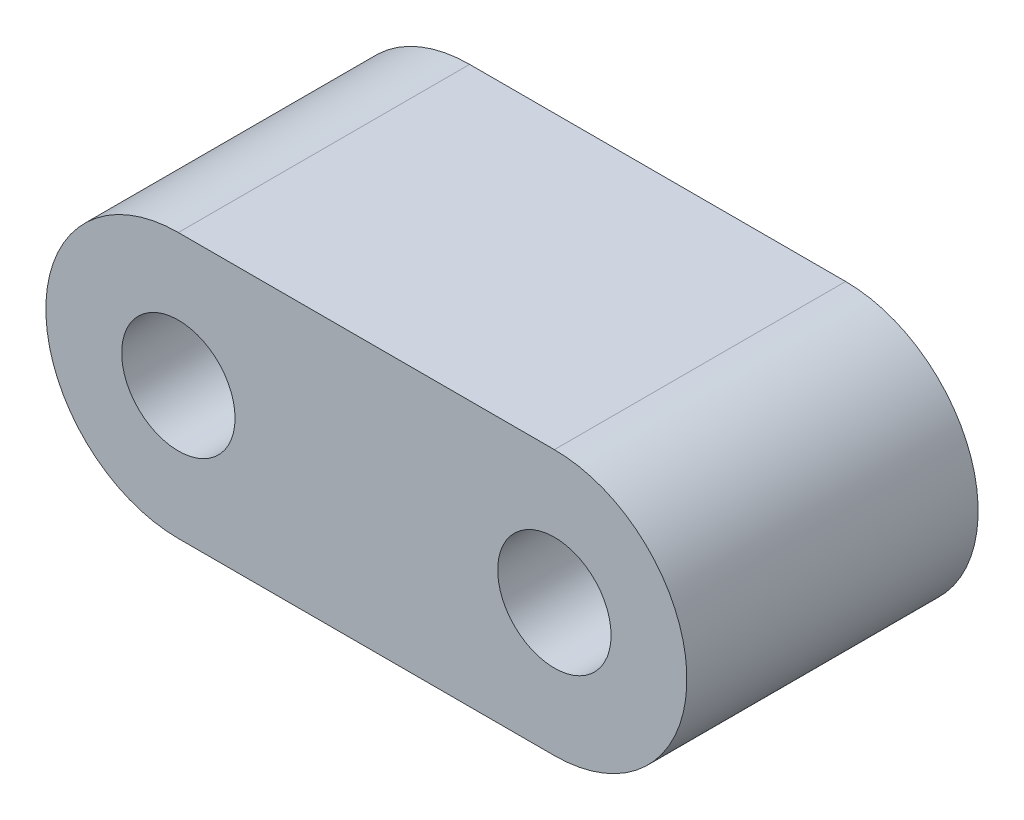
SolidWorks part; units mm, degrees
ref_plane "Front Plane" through (0, 0, 0) normal (0, 0, 1) x (1, 0, 0)
ref_plane "Top Plane" through (0, 0, 0) normal (0, 1, 0) x (1, 0, 0)
ref_plane "Right Plane" through (0, 0, 0) normal (1, 0, 0) x (0, 0, -1)
sketch "Sketch1" plane through (0, 0, 0) normal (0, 0, 1) x (1, 0, 0)
  line L5 (-4.0005, 0) -> (4.0005, 0) construction
  line L6 (-4.0005, 2.8194) -> (4.0005, 2.8194)
  line L7 (-4.0005, -2.8194) -> (4.0005, -2.8194)
  arc A0 (-4.0005, 2.8194) -> (-4.0005, -2.8194) centre (-4.0005, 0) ccw
  arc A1 (4.0005, -2.8194) -> (4.0005, 2.8194) centre (4.0005, 0) ccw
  circle A2 centre (-4.0005, 0) radius 1.2065
  circle A3 centre (4.0005, 0) radius 1.2065
  point P7 (0, 0)
  dimension "D4" = 13.6398
  dimension "D1" = 2.413
  dimension "D2" = 8.001
  dimension "D3" = 5.6388
extrude "Extrude1" add sketch "Sketch1" against normal mid plane 6.1976
